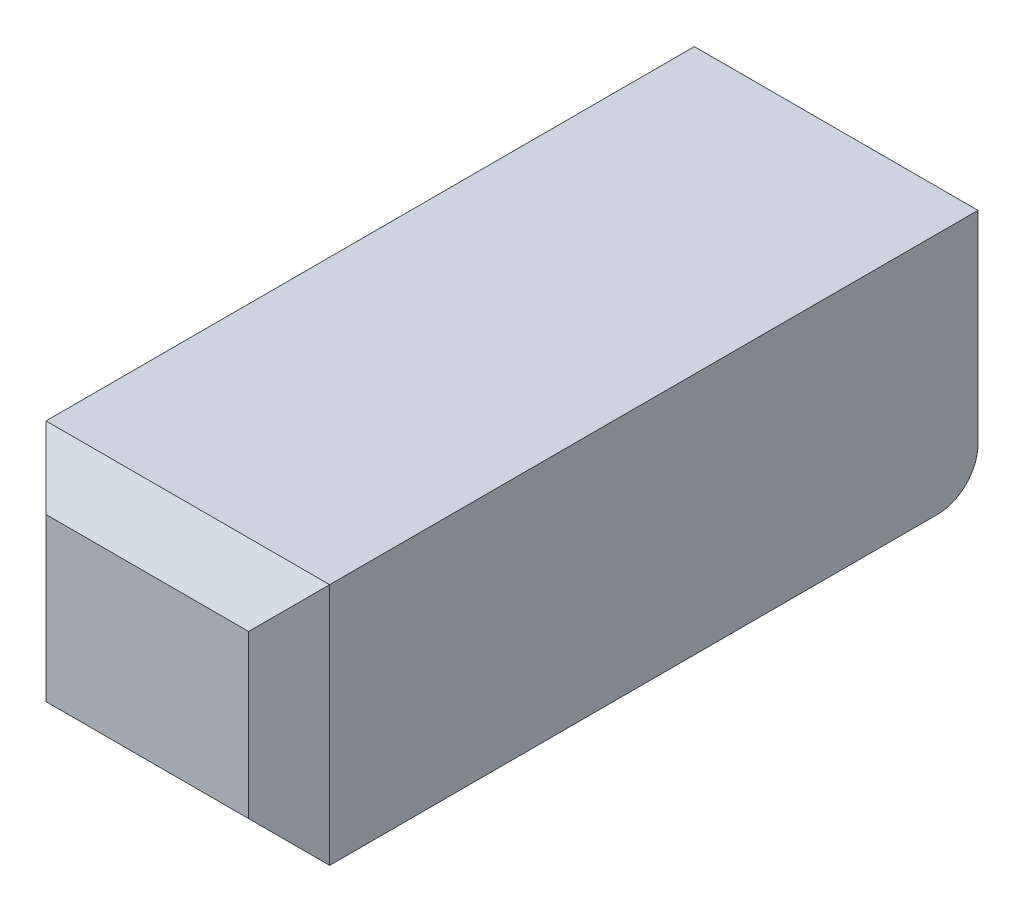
SolidWorks part; units mm, degrees
ref_plane "Front Plane" through (0, 0, 0) normal (0, 0, 1) x (1, 0, 0)
ref_plane "Top Plane" through (0, 0, 0) normal (0, 1, 0) x (1, 0, 0)
ref_plane "Right Plane" through (0, 0, 0) normal (1, 0, 0) x (0, 0, -1)
sketch "Sketch1" plane through (0, 0, 0) normal (0, 1, 0) x (1, 0, 0)
  line L1 (-0.35, 0.85) -> (0.35, 0.85)
  line L2 (-0.35, 0.85) -> (-0.35, -0.85)
  line L3 (-0.35, -0.85) -> (0.35, -0.85)
  line L4 (0.35, 0.85) -> (0.35, -0.85)
  point P4 (0, 0.85)
  point P6 (-0.35, 0)
  dimension "D1" = 0.7
  dimension "D2" = 1.7
extrude "Boss-Extrude1" add sketch "Sketch1" along normal blind 0.6
chamfer "Chamfer1" distance 0.1 angle 45 4 edges at (-0.35, 0.3, 0.85) (0, 0, 0.85) (0.35, 0.3, 0.85) (0, 0.6, 0.85)
fillet "Fillet1" radius 0.1 1 edges at (0, 0, -0.85)
